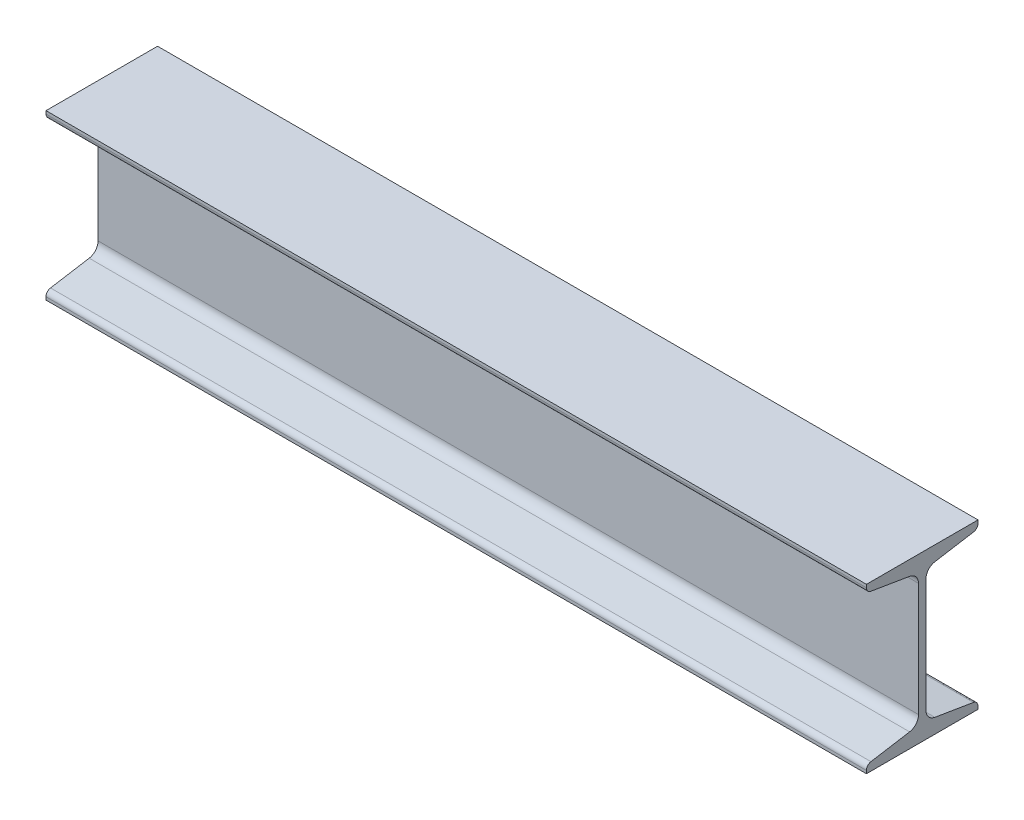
SolidWorks part; units mm, degrees
ref_plane "Front" through (0, 0, 0) normal (0, 0, 1) x (1, 0, 0)
ref_plane "Top" through (0, 0, 0) normal (0, 1, 0) x (1, 0, 0)
ref_plane "Right" through (0, 0, 0) normal (1, 0, 0) x (0, 0, -1)
sketch "Sketch1" plane through (0, 0, 0) normal (1, 0, 0) x (0, 0, -1)
  line L0 (-34, 0) -> (34, 0)
  line L1 (0, 106.3348) -> (0, -35.2641) construction
  line L2 (-2.25, 90.1292) -> (-2.25, 9.8708)
  line L3 (-2.25, 9.8708) -> (-34, 4.5792)
  line L4 (-34, 4.5792) -> (-34, 0)
  line L5 (-34, 4.5792) -> (-2.25, 4.5792) construction
  line L6 (-2.25, 4.5792) -> (-2.25, 9.8708) construction
  line L7 (-15.875, 100) -> (-15.875, 0) construction
  line L8 (-34, 100) -> (34, 100)
  line L9 (-34, 100) -> (-34, 95.4208)
  line L10 (-34, 95.4208) -> (-2.25, 90.1292)
  line L11 (-34, 95.4208) -> (-2.25, 95.4208) construction
  line L12 (-2.25, 95.4208) -> (-2.25, 90.1292) construction
  line L13 (-15.875, 7.6) -> (-15.875, 0) construction
  line L14 (-15.875, 100) -> (-15.875, 92.4) construction
  line L15 (34, 4.5792) -> (34, 0)
  line L16 (2.25, 9.8708) -> (34, 4.5792)
  line L17 (2.25, 90.1292) -> (2.25, 9.8708)
  line L18 (34, 95.4208) -> (2.25, 90.1292)
  line L19 (34, 100) -> (34, 95.4208)
  point P22 (0, 100)
  dimension "d" = 4.5
  dimension "D5" = 5.2917
  dimension "D6" = 15.875
  dimension "h" = 100
  dimension "t" = 7.6
  dimension "D10" = 5.2917
  dimension "t1" = 7.6
  dimension "b" = 68
extrude "Base" add sketch "Sketch1" along normal blind 500
fillet "Fillet1" radius 6.5 4 edges at (250, 90.1292, -2.25) (250, 9.8708, -2.25) (250, 9.8708, 2.25) (250, 90.1292, 2.25)
fillet "Fillet2" radius 3.3 4 edges at (250, 95.4208, 34) (250, 4.5792, 34) (250, 4.5792, -34) (250, 95.4208, -34)
equation "\"D5@Sketch1\" =  ( \"b@Sketch1\" - \"d@Sketch1\" ) /12"
equation "\"D10@Sketch1\" = \"D5@Sketch1\""
equation "\"t1@Sketch1\" = \"t@Sketch1\""
equation "\"D6@Sketch1\" =  ( \"b@Sketch1\" - \"d@Sketch1\" ) /4"
